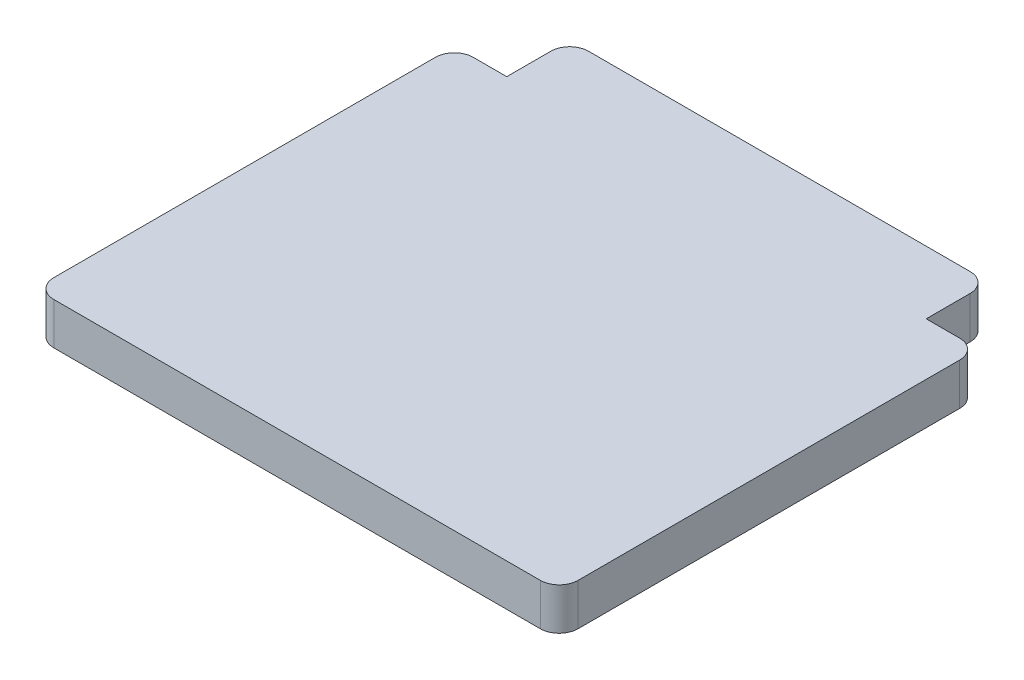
SolidWorks part; units mm, degrees
ref_plane "Plano frontal" through (0, 0, 0) normal (0, 0, 1) x (1, 0, 0)
ref_plane "Plano superior" through (0, 0, 0) normal (0, 1, 0) x (1, 0, 0)
ref_plane "Plano direito" through (0, 0, 0) normal (1, 0, 0) x (0, 0, -1)
sketch "Esboço1" plane through (0, 0, 0) normal (0, 1, 0) x (1, 0, 0)
  line L1 (-11.5998, 10) -> (11.5998, 10)
  line L2 (-12.5, 9.0998) -> (-12.5, -9.0998)
  line L3 (-11.5998, -10) -> (11.5998, -10)
  line L4 (12.5, 9.0998) -> (12.5, -9.0998)
  line L5 (-12.5, 10) -> (12.5, -10) construction
  line L6 (-12.5, -10) -> (12.5, 10) construction
  line L7 (-9.0998, 13) -> (9.0998, 13)
  line L8 (-10, 12.0998) -> (-10, 7)
  line L9 (-10, 7) -> (10, 7)
  line L10 (10, 12.0998) -> (10, 7)
  line L11 (-10, 13) -> (10, 7) construction
  line L12 (-10, 7) -> (10, 13) construction
  arc A0 (9.0998, 13) -> (10, 12.0998) centre (9.0998, 12.0998) cw
  arc A1 (-9.0998, 13) -> (-10, 12.0998) centre (-9.0998, 12.0998) ccw
  arc A2 (-11.5998, 10) -> (-12.5, 9.0998) centre (-11.5998, 9.0998) ccw
  arc A3 (11.5998, 10) -> (12.5, 9.0998) centre (11.5998, 9.0998) cw
  arc A4 (11.5998, -10) -> (12.5, -9.0998) centre (11.5998, -9.0998) ccw
  arc A5 (-12.5, -9.0998) -> (-11.5998, -10) centre (-11.5998, -9.0998) ccw
  point P0 (0, 0)
  point P6 (0, 10)
  dimension "D5" = 0.9002
  dimension "D1" = 25
  dimension "D2" = 20
  dimension "D3" = 23
  dimension "D4" = 20
extrude "Ressalto-extrusão1" add sketch "Esboço1" along normal blind 2 contours L2 A5 L3 A4 L4 A3 L1 L10 L9 L8 A2 | L7 A1 L8 L1 L10 A0 | L10 L1 L8 L9
